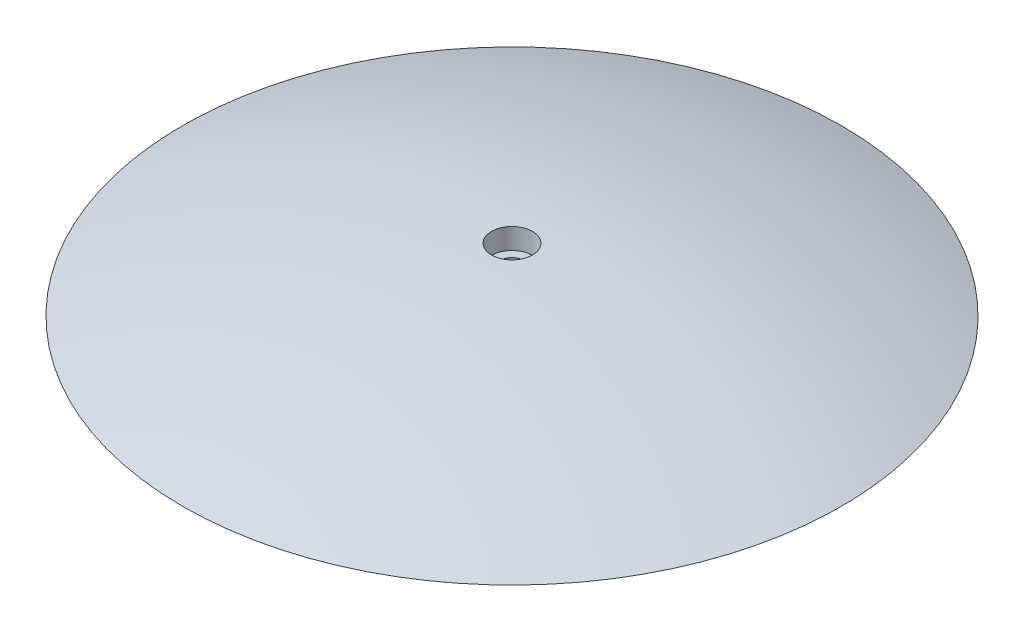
SolidWorks part; units mm, degrees
ref_plane "Front" through (0, 0, 0) normal (0, 0, 1) x (1, 0, 0)
ref_plane "Top" through (0, 0, 0) normal (0, 1, 0) x (1, 0, 0)
ref_plane "Right" through (0, 0, 0) normal (1, 0, 0) x (0, 0, -1)
sketch "Sketch1" plane through (0, 0, 0) normal (0, 0, 1) x (1, 0, 0)
  line L0 (0, 33.4004) -> (0, -29.3923) construction
  line L1 (0.5725, 0) -> (15.875, 0)
  line L2 (-0.5725, 0) -> (-15.875, 0) construction
  line L3 (0.9859, 3.0374) -> (0.9859, 2.0355)
  line L4 (0.9859, 2.0355) -> (0.5725, 2.0355)
  line L5 (0.5725, 2.0355) -> (0.5725, 0)
  line L6 (-0.9859, 3.0374) -> (-0.9859, 2.0355) construction
  line L7 (-0.5725, 2.0355) -> (-0.5725, 0) construction
  arc A0 (15.875, 0) -> (0.9859, 3.0374) centre (-0.3022, -41.2879) ccw
  dimension "D1" = 31.75
  dimension "D2" = 2.2899
  dimension "D3" = 3.9436
  dimension "D4" = 2.0355
  dimension "D5" = 3.0374
revolve "Base-Revolve" add sketch "Sketch1" angle 360 about L0
